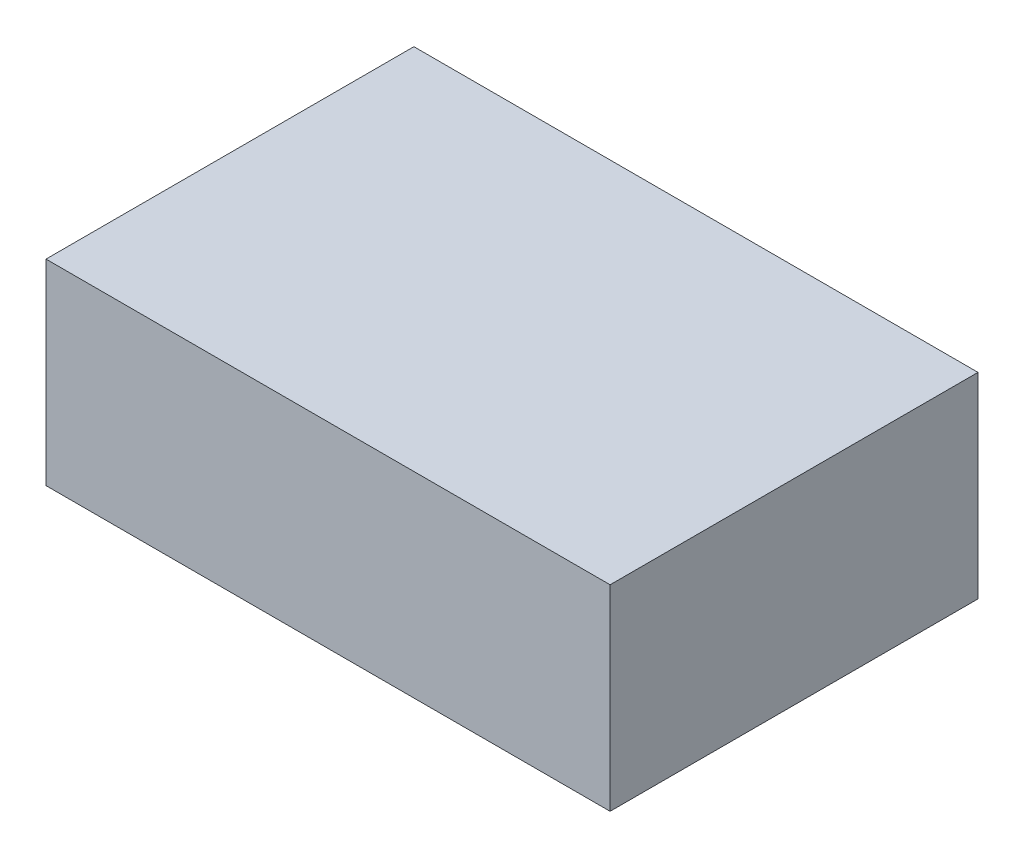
SolidWorks part; units mm, degrees
ref_plane "Ebene vorne" through (0, 0, 0) normal (0, 0, 1) x (1, 0, 0)
ref_plane "Ebene oben" through (0, 0, 0) normal (0, 1, 0) x (1, 0, 0)
ref_plane "Ebene rechts" through (0, 0, 0) normal (1, 0, 0) x (0, 0, -1)
sketch "Skizze1" plane through (0, 0, 0) normal (0, 0, 1) x (1, 0, 0)
  line L8 (2, 18) -> (2, 2)
  line L9 (2, 2) -> (48, 2)
  line L10 (48, 2) -> (48, 18)
  line L11 (48, 18) -> (2, 18)
  line L12 (2, 18) -> (2, 2)
  line L13 (2, 2) -> (48, 2)
  line L14 (48, 2) -> (48, 18)
  line L15 (48, 18) -> (2, 18)
  dimension "D1" = 2
extrude "Aufsatz-Linear austragen1" add sketch "Skizze1" along normal blind 30
